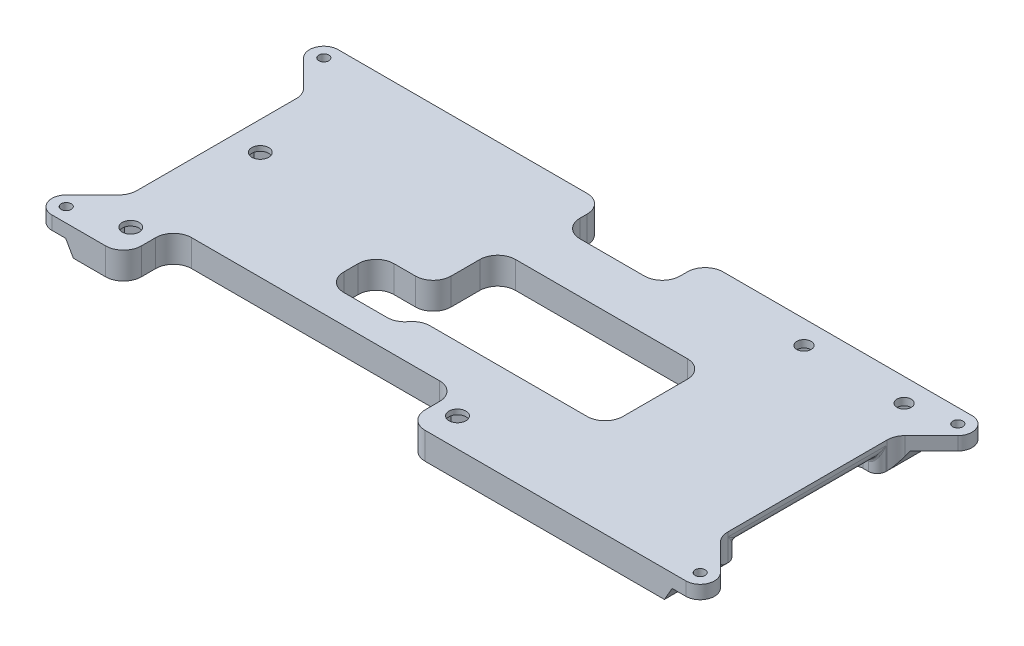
SolidWorks part; units mm, degrees
ref_plane "Plane XZ" through (0, 0, 0) normal (0, 0, 1) x (1, 0, 0)
ref_plane "Plane XY" through (0, 0, 0) normal (0, 1, 0) x (1, 0, 0)
ref_plane "Plane YZ" through (0, 0, 0) normal (1, 0, 0) x (0, 0, -1)
sketch "Sketch1" plane through (0, 0, 0) normal (0, 1, 0) x (1, 0, 0)
  line L0 (-59.817, 0) -> (59.817, 0) construction
  line L1 (-59.817, 25.4) -> (59.817, 25.4) construction
  line L2 (-59.817, 25.4) -> (-59.817, -25.4) construction
  line L3 (-59.817, -25.4) -> (59.817, -25.4) construction
  line L4 (59.817, 25.4) -> (59.817, -25.4) construction
  line L5 (-56.261, 25.4) -> (-8.89, 25.4)
  line L6 (-56.261, 22.86) -> (56.261, 22.86) construction
  line L7 (-56.261, 22.86) -> (-56.261, -22.86) construction
  line L8 (-56.261, -22.86) -> (56.261, -22.86) construction
  line L9 (56.261, 22.86) -> (56.261, -22.86) construction
  line L10 (-8.89, 17.78) -> (8.89, 17.78)
  line L11 (0, 17.78) -> (0, 0) construction
  line L12 (-58.0571, 21.0639) -> (-52.451, 15.4579)
  line L13 (-52.451, 15.4579) -> (-52.451, -15.4579)
  line L14 (-8.89, 25.4) -> (-8.89, 17.78)
  line L15 (8.89, 25.4) -> (8.89, 17.78)
  line L16 (56.261, 25.4) -> (8.89, 25.4)
  line L17 (58.0571, 21.0639) -> (52.451, 15.4579)
  line L18 (52.451, 15.4579) -> (52.451, -15.4579)
  line L19 (-58.0571, -21.0639) -> (-52.451, -15.4579)
  line L20 (-56.261, -25.4) -> (-8.89, -25.4)
  line L21 (-8.89, -25.4) -> (-8.89, -17.78) construction
  line L22 (-8.89, -17.78) -> (8.89, -17.78) construction
  line L23 (8.89, -25.4) -> (8.89, -17.78) construction
  line L24 (56.261, -25.4) -> (8.89, -25.4)
  line L25 (58.0571, -21.0639) -> (52.451, -15.4579)
  line L26 (8.89, -25.4) -> (-8.89, -25.4)
  line L27 (25.4, 8.89) -> (-11.43, 8.89)
  line L32 (-11.43, 8.89) -> (-11.43, -2.54)
  line L33 (-11.43, -2.54) -> (-21.59, -2.54)
  line L34 (-21.59, -2.54) -> (-21.59, -11.43)
  line L35 (-21.59, -11.43) -> (-7.62, -11.43)
  line L36 (-7.62, -11.43) -> (-7.62, -8.89)
  line L37 (-7.62, -8.89) -> (25.4, -8.89)
  line L38 (25.4, -8.89) -> (25.4, 8.89)
  circle A0 centre (-56.261, 22.86) radius 0.889
  circle A1 centre (-56.261, -22.86) radius 0.889
  circle A2 centre (56.261, -22.86) radius 0.889
  circle A3 centre (56.261, 22.86) radius 0.889
  circle A4 centre (-56.261, 22.86) radius 2.54 construction
  circle A5 centre (-56.261, -22.86) radius 2.54 construction
  circle A6 centre (56.261, -22.86) radius 2.54 construction
  circle A7 centre (56.261, 22.86) radius 2.54 construction
  arc A8 (-58.0571, 21.0639) -> (-56.261, 25.4) centre (-56.261, 22.86) cw
  arc A9 (58.0571, 21.0639) -> (56.261, 25.4) centre (56.261, 22.86) ccw
  arc A10 (-58.0571, -21.0639) -> (-56.261, -25.4) centre (-56.261, -22.86) ccw
  arc A11 (58.0571, -21.0639) -> (56.261, -25.4) centre (56.261, -22.86) cw
  point P39 (-52.451, 0)
  point P44 (52.451, 0)
  dimension "D7" = 1.778
  dimension "D8" = 5.08
  dimension "D1" = 119.634
  dimension "D2" = 50.8
  dimension "D3" = 3.556
  dimension "D4" = 3.81
  dimension "D5" = 2.54
  dimension "D6" = 17.78
  dimension "D9" = 8.89
  dimension "D10" = 45
  dimension "D11" = 8.89
  dimension "D12" = 8.89
  dimension "D13" = 25.4
  dimension "D14" = 11.43
  dimension "D15" = 7.62
  dimension "D16" = 21.59
  dimension "D17" = 2.54
  dimension "D18" = 11.43
extrude "Boss-Extrude1" add sketch "Sketch1" along normal mid plane 4.7625
sketch "Sketch21" plane through (0, -2.3813, 0) normal (0, -1, 0) x (1, 0, 0)
  line L1 (14.1365, -6.1875) -> (-50.8635, -6.1875) construction
  line L2 (14.1365, -6.1875) -> (14.1365, 23.8125) construction
  line L3 (14.1365, 23.8125) -> (-50.8635, 23.8125) construction
  line L4 (-50.8635, -6.1875) -> (-50.8635, 23.8125) construction
  line L5 (10.6365, -2.6875) -> (-47.3635, -2.6875) construction
  line L6 (10.6365, -2.6875) -> (10.6365, 20.3125) construction
  line L7 (10.6365, 20.3125) -> (-47.3635, 20.3125) construction
  line L8 (-47.3635, -2.6875) -> (-47.3635, 20.3125) construction
  line L10 (-56.261, 25.4) -> (56.261, 25.4) construction
  line L11 (-52.451, -15.4579) -> (-52.451, 15.4579) construction
  line L13 (-43.5535, 25.4) -> (6.8265, 25.4)
  line L14 (-43.5535, 25.4) -> (-43.5535, 16.5025)
  line L15 (-43.5535, 16.5025) -> (6.8265, 16.5025)
  line L16 (6.8265, 25.4) -> (6.8265, 16.5025)
  circle A0 centre (10.6365, -2.6875) radius 1.5 construction
  circle A1 centre (-47.3635, -2.6875) radius 1.5
  circle A2 centre (10.6365, 20.3125) radius 1.5
  circle A3 centre (-47.3635, 20.3125) radius 1.5
  dimension "D7" = 3
  dimension "D11" = 3.81
  dimension "D1" = 65
  dimension "D2" = 30
  dimension "D3" = 3.5
  dimension "D4" = 3.5
  dimension "D5" = 3.5
  dimension "D6" = 3.5
  dimension "D8" = 1.5875
  dimension "D9" = 1.5875
  dimension "D10" = 3.81
  dimension "D12" = 3.81
extrude "Cut-Extrude8" cut sketch "Sketch21" against normal through all
sketch "Sketch23" plane through (0, 0, 0) normal (0, 1, 0) x (1, 0, 0)
  line L1 (7.9695, -18.7727) -> (7.9695, -21.8523)
  line L2 (7.9695, -21.8523) -> (10.6365, -23.3921)
  line L3 (10.6365, -23.3921) -> (13.3035, -21.8523)
  line L4 (13.3035, -21.8523) -> (13.3035, -18.7727)
  line L5 (13.3035, -18.7727) -> (10.6365, -17.2329)
  line L6 (10.6365, -17.2329) -> (7.9695, -18.7727)
  line L7 (-50.0305, -18.7727) -> (-50.0305, -21.8523)
  line L8 (-50.0305, -21.8523) -> (-47.3635, -23.3921)
  line L9 (-47.3635, -23.3921) -> (-44.6965, -21.8523)
  line L10 (-44.6965, -21.8523) -> (-44.6965, -18.7727)
  line L11 (-44.6965, -18.7727) -> (-47.3635, -17.2329)
  line L12 (-47.3635, -17.2329) -> (-50.0305, -18.7727)
  line L13 (-47.3635, 5.7671) -> (-50.0305, 4.2273)
  line L14 (-50.0305, 4.2273) -> (-50.0305, 1.1477)
  line L15 (-50.0305, 1.1477) -> (-47.3635, -0.3921)
  line L16 (-47.3635, -0.3921) -> (-44.6965, 1.1477)
  line L17 (-44.6965, 1.1477) -> (-44.6965, 4.2273)
  line L18 (-44.6965, 4.2273) -> (-47.3635, 5.7671)
  circle A0 centre (10.6365, -20.3125) radius 2.667 construction
  circle A1 centre (-47.3635, -20.3125) radius 2.667 construction
  circle A2 centre (-47.3635, 2.6875) radius 2.667 construction
  dimension "D1" = 5.334
extrude "Cut-Extrude9" cut sketch "Sketch23" against normal mid plane 3
sketch "Sketch24" plane through (0, -1.5, 0) normal (0, 1, 0) x (1, 0, 0)
  line L0 (7.9695, -21.8523) -> (9.1365, -22.5261)
  line L1 (9.1365, -22.5261) -> (9.1365, -18.0989)
  line L2 (9.1365, -18.0989) -> (7.9695, -18.7727)
  line L3 (13.3035, -18.7727) -> (12.1365, -18.0989)
  line L4 (12.1365, -18.0989) -> (12.1365, -22.5261)
  line L5 (12.1365, -22.5261) -> (13.3035, -21.8523)
  line L6 (10.6365, -17.2329) -> (7.9695, -18.7727)
  line L7 (13.3035, -18.7727) -> (10.6365, -17.2329)
  line L8 (13.3035, -21.8523) -> (13.3035, -18.7727)
  line L9 (10.6365, -23.3921) -> (13.3035, -21.8523)
  line L10 (7.9695, -21.8523) -> (10.6365, -23.3921)
  line L11 (7.9695, -18.7727) -> (7.9695, -21.8523)
  line L12 (10.6365, -17.2329) -> (7.9695, -18.7727) construction
  line L13 (13.3035, -18.7727) -> (10.6365, -17.2329) construction
  line L14 (13.3035, -21.8523) -> (13.3035, -18.7727)
  line L15 (10.6365, -23.3921) -> (13.3035, -21.8523) construction
  line L16 (7.9695, -21.8523) -> (10.6365, -23.3921) construction
  line L17 (7.9695, -18.7727) -> (7.9695, -21.8523)
  line L18 (-44.6965, 4.2273) -> (-47.3635, 5.7671)
  line L19 (-44.6965, 1.1477) -> (-44.6965, 4.2273)
  line L20 (-47.3635, -0.3921) -> (-44.6965, 1.1477)
  line L21 (-50.0305, 1.1477) -> (-47.3635, -0.3921)
  line L22 (-50.0305, 4.2273) -> (-50.0305, 1.1477)
  line L23 (-47.3635, 5.7671) -> (-50.0305, 4.2273)
  line L24 (-44.6965, 4.2273) -> (-47.3635, 5.7671) construction
  line L25 (-44.6965, 1.1477) -> (-44.6965, 4.2273)
  line L26 (-47.3635, -0.3921) -> (-44.6965, 1.1477) construction
  line L27 (-50.0305, 1.1477) -> (-47.3635, -0.3921) construction
  line L28 (-50.0305, 4.2273) -> (-50.0305, 1.1477)
  line L29 (-47.3635, 5.7671) -> (-50.0305, 4.2273) construction
  line L30 (-47.3635, -17.2329) -> (-50.0305, -18.7727)
  line L31 (-44.6965, -18.7727) -> (-47.3635, -17.2329)
  line L32 (-44.6965, -21.8523) -> (-44.6965, -18.7727)
  line L33 (-47.3635, -23.3921) -> (-44.6965, -21.8523)
  line L34 (-50.0305, -21.8523) -> (-47.3635, -23.3921)
  line L35 (-50.0305, -18.7727) -> (-50.0305, -21.8523)
  line L36 (-47.3635, -17.2329) -> (-50.0305, -18.7727) construction
  line L37 (-44.6965, -18.7727) -> (-47.3635, -17.2329) construction
  line L38 (-44.6965, -21.8523) -> (-44.6965, -18.7727)
  line L39 (-47.3635, -23.3921) -> (-44.6965, -21.8523) construction
  line L40 (-50.0305, -21.8523) -> (-47.3635, -23.3921) construction
  line L41 (-50.0305, -18.7727) -> (-50.0305, -21.8523)
  line L42 (-50.0305, -21.8523) -> (-48.8635, -22.5261)
  line L43 (-48.8635, -22.5261) -> (-48.8635, -18.0989)
  line L44 (-48.8635, -18.0989) -> (-50.0305, -18.7727)
  line L45 (-44.6965, -18.7727) -> (-45.8635, -18.0989)
  line L46 (-45.8635, -18.0989) -> (-45.8635, -22.5261)
  line L47 (-45.8635, -22.5261) -> (-44.6965, -21.8523)
  line L48 (-50.0305, 1.1477) -> (-48.8635, 0.4739)
  line L49 (-48.8635, 0.4739) -> (-48.8635, 4.9011)
  line L50 (-48.8635, 4.9011) -> (-50.0305, 4.2273)
  line L51 (-44.6965, 4.2273) -> (-45.8635, 4.9011)
  line L52 (-45.8635, 4.9011) -> (-45.8635, 0.4739)
  line L53 (-45.8635, 0.4739) -> (-44.6965, 1.1477)
  circle A0 centre (10.6365, -20.3125) radius 1.5 construction
  circle A1 centre (-47.3635, -20.3125) radius 1.5 construction
  circle A2 centre (-47.3635, 2.6875) radius 1.5 construction
  dimension "D1" = 0
  dimension "D2" = 0
  dimension "D3" = 0
extrude "Boss-Extrude11" add sketch "Sketch24" along normal blind 0.5
sketch "Sketch26" plane through (0, -2.3813, 0) normal (0, -1, 0) x (1, 0, 0)
  line L0 (39.4335, -23.8125) -> (39.4335, 12.5095) construction
  line L1 (50.8635, -23.8125) -> (28.0035, -23.8125) construction
  line L2 (50.8635, -23.8125) -> (50.8635, 12.5095) construction
  line L3 (50.8635, 12.5095) -> (28.0035, 12.5095) construction
  line L4 (28.0035, -23.8125) -> (28.0035, 12.5095) construction
  line L5 (52.451, 15.4579) -> (52.451, -15.4579) construction
  line L6 (50.8635, -5.6515) -> (52.451, -5.6515) construction
  line L7 (48.3235, 12.5095) -> (48.3235, -12.3825) construction
  line L8 (48.3235, -12.3825) -> (50.8635, -12.3825) construction
  line L9 (56.261, -25.4) -> (8.89, -25.4) construction
  line L10 (48.3235, 6.6675) -> (35.6235, 6.6675) construction
  line L11 (35.6235, 6.6675) -> (35.6235, 12.5095) construction
  circle A0 centre (48.3235, -21.2725) radius 1.27
  circle A1 centre (30.5435, -21.2725) radius 1.27
  dimension "D5" = 2.54
  dimension "D1" = 36.322
  dimension "D2" = 22.86
  dimension "D3" = 17.78
  dimension "D4" = 2.54
  dimension "D6" = 1.5875
  dimension "D7" = 2.54
  dimension "D8" = 11.43
  dimension "D9" = 1.5875
  dimension "D10" = 15.24
  dimension "D11" = 30.48
extrude "Cut-Extrude10" cut sketch "Sketch26" against normal through all
sketch "Sketch27" plane through (0, -1, 0) normal (0, 1, 0) x (1, 0, 0)
  line L1 (45.7835, 22.739) -> (45.7835, 19.806)
  line L2 (45.7835, 19.806) -> (48.3235, 18.3396)
  line L3 (48.3235, 18.3396) -> (50.8635, 19.806)
  line L4 (50.8635, 19.806) -> (50.8635, 22.739)
  line L5 (50.8635, 22.739) -> (48.3235, 24.2054)
  line L6 (48.3235, 24.2054) -> (45.7835, 22.739)
  line L7 (28.0035, 22.739) -> (28.0035, 19.806)
  line L8 (28.0035, 19.806) -> (30.5435, 18.3396)
  line L9 (30.5435, 18.3396) -> (33.0835, 19.806)
  line L10 (33.0835, 19.806) -> (33.0835, 22.739)
  line L11 (33.0835, 22.739) -> (30.5435, 24.2054)
  line L12 (30.5435, 24.2054) -> (28.0035, 22.739)
  circle A0 centre (48.3235, 21.2725) radius 2.54 construction
  circle A1 centre (30.5435, 21.2725) radius 2.54 construction
  dimension "D1" = 5.08
extrude "Cut-Extrude11" cut sketch "Sketch27" along normal blind 2.0875
sketch "Sketch28" plane through (0, -1, 0) normal (0, 1, 0) x (1, 0, 0)
  line L0 (28.0035, 22.739) -> (28.0035, 19.806) construction
  line L1 (28.0035, 22.5425) -> (33.0835, 22.5425)
  line L2 (28.0035, 22.5425) -> (28.0035, 20.0025)
  line L3 (28.0035, 20.0025) -> (33.0835, 20.0025)
  line L4 (33.0835, 22.5425) -> (33.0835, 20.0025)
  line L5 (45.7835, 22.5425) -> (50.8635, 22.5425)
  line L6 (45.7835, 22.5425) -> (45.7835, 20.0025)
  line L7 (45.7835, 20.0025) -> (50.8635, 20.0025)
  line L8 (50.8635, 22.5425) -> (50.8635, 20.0025)
  line L9 (33.0835, 19.806) -> (33.0835, 22.739) construction
  line L10 (50.8635, 19.806) -> (50.8635, 22.739) construction
  line L11 (45.7835, 22.739) -> (45.7835, 19.806) construction
  circle A0 centre (48.3235, 21.2725) radius 1.27 construction
  circle A1 centre (30.5435, 21.2725) radius 1.27 construction
extrude "Cut-Extrude12" cut sketch "Sketch28" against normal blind 0.5
sketch "Sketch31" plane through (0, -2.3813, 0) normal (0, -1, 0) x (1, 0, 0)
  line L0 (52.451, 15.4579) -> (52.451, -15.4579) construction
  line L1 (52.451, 12.5095) -> (48.3235, 12.5095)
  line L2 (52.451, 12.5095) -> (52.451, -12.3825)
  line L3 (52.451, -12.3825) -> (48.3235, -12.3825)
  line L4 (48.3235, 12.5095) -> (48.3235, -12.3825) construction
  line L5 (50.8635, 12.5095) -> (28.0035, 12.5095) construction
  line L6 (35.6235, 6.6675) -> (35.6235, 12.5095) construction
  line L7 (48.3235, 6.6675) -> (35.6235, 6.6675) construction
  line L8 (35.6235, 6.6675) -> (35.6235, 12.5095)
  line L9 (48.3235, 6.6675) -> (35.6235, 6.6675)
  line L10 (48.3235, -12.3825) -> (48.3235, 6.6675)
  line L11 (48.3235, 12.5095) -> (35.6235, 12.5095)
extrude "Cut-Extrude14" cut sketch "Sketch31" against normal blind 2.3813
fillet "Fillet3" radius 1.5875 6 edges at (35.6235, -1.1906, 12.5095) (35.6235, -1.1906, 6.6675) (48.3235, -1.1906, -12.3825) (48.3235, -1.1906, 6.6675) (52.451, -1.1906, 12.5095) (52.451, -1.1906, -12.3825)
fillet "Fillet4" radius 1.5875 1 edges at (52.451, 0, 0.0635)
fillet "Fillet5" radius 0.7937 11 edges at (51.986, 0.465, 12.9745) (44.0373, 0, 12.5095) (36.0885, 0, 12.0445) (35.6235, 0, 9.5885) (36.0885, 0, 7.1325) (41.9735, 0, 6.6675) (47.8585, 0, 6.2025) (51.986, 0.465, -12.8475) (50.3873, 0, -12.3825) (48.7885, 0, -11.9175) (48.3235, 0, -2.8575)
fillet "Fillet1" radius 3.175 21 edges at (-43.5535, 0, 16.5025) (-43.5535, 0, 25.4) (6.8265, 0, 25.4) (6.8265, 0, 16.5025) (-8.89, 0, -25.4) (-8.89, 0, -17.78) (8.89, 0, -17.78) (8.89, 0, -25.4) (52.451, 0, -15.4579) (52.451, 0, 15.4579) (-52.451, 0, 15.4579) (-52.451, 0, -15.4579) (25.4, 0, 8.89) (25.4, 0, -8.89) (-11.43, 0, -8.89) (-11.43, 0, 2.54) (-21.59, 0, 2.54) (-21.59, 0, 11.43) (-7.62, -2.3813, 10.16) (-7.62, 0, 11.43) (-7.62, 2.3813, 10.16)
fillet "Fillet2" radius 3.175 1 edges at (-7.62, 0, 8.89)
sketch "Sketch29" plane through (0, 0, 25.4) normal (0, 0, 1) x (1, 0, 0)
  line L0 (66.3072, 0) -> (53.8258, 0)
  line L1 (53.8258, 0) -> (52.451, -2.3813)
  line L2 (52.451, -2.3813) -> (66.3072, -2.3813)
  line L3 (66.3072, -2.3813) -> (66.3072, 0)
  line L4 (10.0015, 2.3813) -> (56.261, 2.3813) construction
  line L5 (10.0015, -2.3813) -> (56.261, -2.3813) construction
  line L6 (0, -38.5807) -> (0, 10.7666) construction
  line L7 (-66.3072, -2.3813) -> (-66.3072, 0)
  line L8 (-52.451, -2.3813) -> (-66.3072, -2.3813)
  line L9 (-53.8258, 0) -> (-52.451, -2.3813)
  line L10 (-66.3072, 0) -> (-53.8258, 0)
  dimension "D1" = 2.3813
  dimension "D2" = 60
extrude "Cut-Extrude13" cut sketch "Sketch29" against normal through all
sketch "PCB Outlines" plane through (0, -2.3813, 0) normal (0, -1, 0) x (1, 0, 0)
  line L0 (-50.8635, -6.1875) -> (-50.8635, 23.8125) construction
  line L1 (14.1365, -6.1875) -> (-50.8635, -6.1875) construction
  line L2 (14.1365, -6.1875) -> (14.1365, 23.8125) construction
  line L3 (14.1365, 23.8125) -> (-50.8635, 23.8125) construction
  line L4 (-50.8635, -6.1875) -> (-50.8635, 23.8125)
  line L5 (14.1365, -6.1875) -> (-50.8635, -6.1875)
  line L6 (14.1365, -6.1875) -> (14.1365, 23.8125)
  line L7 (14.1365, 23.8125) -> (-50.8635, 23.8125)
  line L8 (50.8635, 12.5095) -> (28.0035, 12.5095) construction
  line L9 (28.0035, -23.8125) -> (28.0035, 12.5095) construction
  line L10 (50.8635, -23.8125) -> (28.0035, -23.8125) construction
  line L11 (50.8635, -23.8125) -> (50.8635, 12.5095) construction
  line L12 (50.8635, 12.5095) -> (28.0035, 12.5095)
  line L13 (28.0035, -23.8125) -> (28.0035, 12.5095)
  line L14 (50.8635, -23.8125) -> (28.0035, -23.8125)
  line L15 (50.8635, -23.8125) -> (50.8635, 12.5095)
sketch "Sketch32" plane through (0, -2.3813, 0) normal (0, -1, 0) x (1, 0, 0)
  line L0 (10.0015, 25.4) -> (52.451, 25.4) construction
  line L1 (34.925, 17.78) -> (32.893, 17.78)
  line L2 (34.925, 17.78) -> (34.925, 20.32)
  line L3 (34.925, 20.32) -> (32.893, 20.32)
  line L4 (32.893, 17.78) -> (32.893, 20.32)
  line L5 (29.718, 17.78) -> (27.686, 17.78)
  line L6 (29.718, 17.78) -> (29.718, 20.32)
  line L7 (29.718, 20.32) -> (27.686, 20.32)
  line L8 (27.686, 17.78) -> (27.686, 20.32)
  dimension "D1" = 3.175
  dimension "D2" = 2.032
  dimension "D3" = 2.54
  dimension "D4" = 5.08
  dimension "D5" = 34.925
extrude "Boss-Extrude12" add sketch "Sketch32" along normal blind 1.27
sketch "Sketch33" plane through (0, -3.6513, 0) normal (0, -1, 0) x (1, 0, 0)
  line L1 (34.925, 20.32) -> (27.686, 20.32)
  line L2 (34.925, 20.32) -> (34.925, 17.78)
  line L3 (34.925, 17.78) -> (27.686, 17.78)
  line L4 (27.686, 20.32) -> (27.686, 17.78)
extrude "Boss-Extrude13" add sketch "Sketch33" along normal blind 1.27
sketch "Sketch34" plane through (0, -2.3813, 0) normal (0, -1, 0) x (1, 0, 0)
  line L0 (-12.065, -25.4) -> (-52.451, -25.4) construction
  point P0 (34.925, 20.32)
  point P5 (-25.4, -15.875)
  dimension "D1" = 9.525
  dimension "D2" = 25.4
pattern_sketch "Sketch-Pattern1" of "Boss-Extrude12", "Boss-Extrude13"
